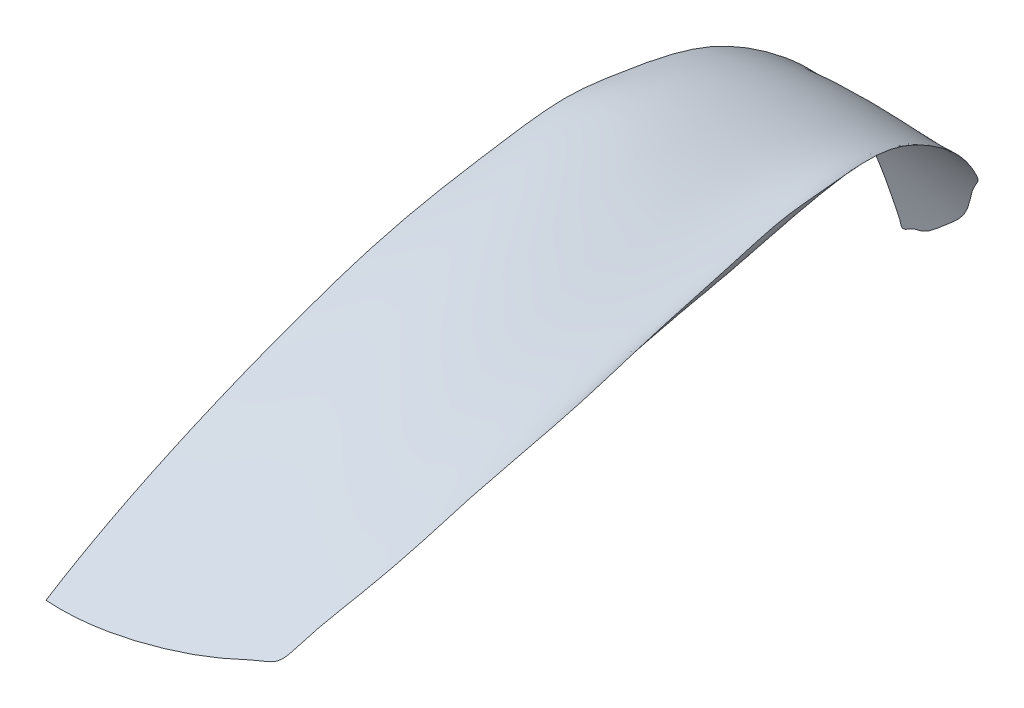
SolidWorks part; units mm, degrees
ref_plane "Front Plane" through (0, 0, 0) normal (0, 0, 1) x (1, 0, 0)
ref_plane "Top Plane" through (0, 0, 0) normal (0, 1, 0) x (1, 0, 0)
ref_plane "Right Plane" through (0, 0, 0) normal (1, 0, 0) x (0, 0, -1)
sketch "Sketch1" plane through (0, 0, 0) normal (0, 1, 0) x (1, 0, 0)
  line L0 (0, 0) -> (0, 100) construction
  dimension "D1" = 100
sketch "Sketch2" plane through (0, 0, 0) normal (1, 0, 0) x (0, 0, -1)
  line L0 (0, 0) -> (0, 31.1978) construction
  line L1 (0, 0) -> (100, 0) construction
sketch "Sketch3" plane through (0, 0, 0) normal (0, 1, 0) x (1, 0, 0)
  spline S0 degree 3 poles (0, 100) (2.217, 100.3162) (5.6016, 99.1596) (10.4915, 97.7687) (13.1298, 95.2166) (15.3546, 94.0696) (15.7359, 93.2722) knots 0 0 0 0 0.369989 0.609246 0.846882 1 1 1 1
  spline S1 degree 3 poles (15.7359, 93.2722) (16.5801, 91.5066) (18.1132, 87.5287) (20.0947, 80.6163) (22.3508, 73.1046) (24.3999, 65.17) (25.92, 56.2417) (26.7431, 46.1048) (27.5346, 34.6131) (25.9711, 24.0759) (25.5102, 15.7946) (23.0872, 6.8514) (22.9761, 4.3357) (21.1532, 4.0912) (20.1459, 3.6569) knots 0 0 0 0 0.064538 0.141304 0.238018 0.32449 0.412659 0.537572 0.661991 0.791379 0.894262 0.924463 0.963249 1 1 1 1
  spline S2 degree 3 poles (0, 0) (4.5454, -0.2098) (11.7789, 0.7747) (17.8067, 2.6483) (20.1459, 3.6569) knots 0 0 0 0 0.670334 1 1 1 1
sketch "Sketch4" plane through (0, 0, 0) normal (1, 0, 0) x (0, 0, -1)
  line L0 (0, 0) -> (0, 31.1978) construction
  spline S0 degree 3 poles (0, 11.3392) (4.7252, 14.3157) (14.3095, 19.2511) (28.1735, 24.8791) (41.2367, 29.2141) (51.9601, 30.9067) (60.7939, 32.2153) (68.5123, 31.0778) (76.8337, 29.5779) (84.7636, 24.8613) (94.4555, 16.2964) (97.9327, 6.4346) (100, 0) knots 0 0 0 0 0.140065 0.269798 0.375426 0.484164 0.542299 0.597817 0.678921 0.752311 0.826135 1 1 1 1
curve "Curve1"
sketch "Sketch5" plane through (0, 0, 0) normal (1, 0, 0) x (0, 0, -1)
  spline S0 degree 3 poles (966.9909, -1729.0613) (-145.6272, -165.4374) (-82.4061, -20.0102) (28.1735, 24.8791) (41.2367, 29.2141) (51.9601, 30.9067) (60.7939, 32.2153) (68.5123, 31.0778) (76.8337, 29.5779) (84.7636, 24.8613) (142.862, -26.4813) (-24.69, -257.6851) (1315.0967, 1587.5992) knots -2.618972 -2.618972 -2.618972 -2.618972 0.140065 0.269798 0.375426 0.484164 0.542299 0.597817 0.678921 0.752311 0.826135 2.603626 2.603626 2.603626 2.603626 only from (0, 11.3392) to (100, 0) construction
  spline S1 degree 3 poles (0, 11.3392) (4.7252, 14.3157) (14.3095, 19.2511) (28.1735, 24.8791) (41.2367, 29.2141) (51.9601, 30.9067) (60.7939, 32.2153) (68.5123, 31.0778) (76.8337, 29.5779) (84.7636, 24.8613) (94.4555, 16.2964) (97.9327, 6.4346) (100, 0) knots 0 0 0 0 0.140065 0.269798 0.375426 0.484164 0.542299 0.597817 0.678921 0.752311 0.826135 1 1 1 1
sketch3d "3DSketch1"
  spline S1 degree 3 poles (0, 11.3392, 0) (1.1609, 11.3047, 0.0549) (2.3265, 11.3077, 0.0501) (3.4908, 11.3392, 0) knots 0 0 0 0 1 1 1 1
  spline S2 degree 3 poles (3.4908, 11.3392, 0) (6.3769, 11.4174, -0.1241) (9.233, 11.6708, -0.5254) (13.4284, 12.2205, -1.4248) (14.8174, 12.4304, -1.7713) (17.5308, 12.9268, -2.606) (18.8526, 13.2161, -3.0993) (20.1459, 13.5359, -3.6569) knots 0 0 0 0 0.5 0.5 0.75 0.75 1 1 1 1 construction
sketch3d "3DSketch3"
  spline S0 degree 3 poles (2.3079, 0, -100) (2.2844, -0.0093, -100.003) (1.3923, -0.358, -100.11) (0.8585, -0.2665, -99.8538) (0, 0, -100) knots 0 0 0 0 0.026337 1 1 1 1
  spline S1 degree 3 poles (15.7359, 15.6728, -93.2722) (15.4939, 14.8878, -93.7783) (15.015, 14.2019, -94.1793) (14.1885, 13.2152, -94.7267) (13.9011, 12.8899, -94.9014) (13.3733, 12.2109, -95.2549) (13.1288, 11.8591, -95.4323) (11.9594, 10.0613, -96.3107) (11.1992, 8.474, -96.9881) (9.69, 6.3433, -97.8203) (9.1191, 5.6825, -98.0662) (7.872, 4.4404, -98.5154) (7.196, 3.8588, -98.7189) (5.8674, 2.674, -99.1243) (5.2274, 2.0602, -99.3292) (3.8656, 0.8972, -99.7111) (3.1661, 0.3401, -99.8907) (2.3079, 0, -100) knots 0 0 0 0 0.125 0.125 0.1875 0.1875 0.25 0.25 0.5 0.5 0.625 0.625 0.75 0.75 0.875 0.875 1 1 1 1 construction
  spline S2 degree 3 poles (0, 11.3392, 0) (0, 14.3157, -4.7252) (0, 19.2511, -14.3095) (0, 24.8791, -28.1735) (0, 29.2141, -41.2367) (0, 30.9067, -51.9601) (0, 32.2153, -60.7939) (0, 31.0778, -68.5123) (0, 29.5779, -76.8337) (0, 24.8613, -84.7636) (0, 16.2964, -94.4555) (0, 6.4346, -97.9327) (0, 0, -100) knots 0 0 0 0 0.140065 0.269798 0.375426 0.484164 0.542299 0.597817 0.678921 0.752311 0.826135 1 1 1 1 construction
surface "Surface-Fill1"
